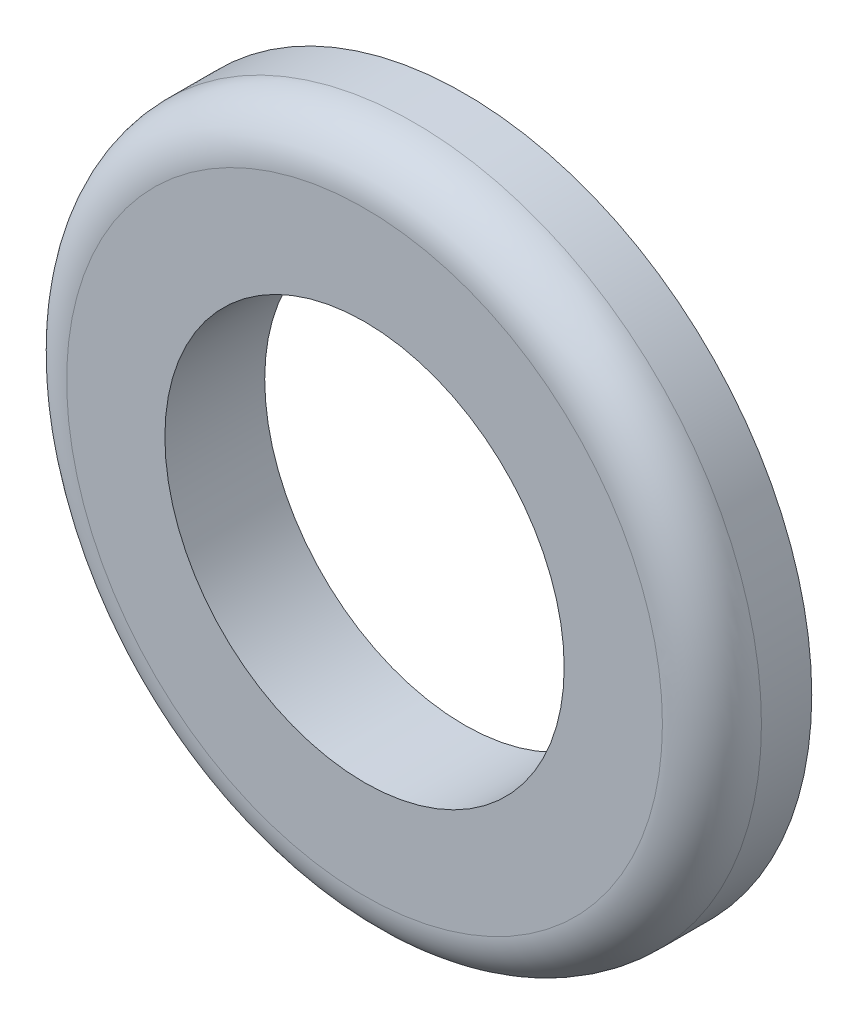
SolidWorks part; units mm, degrees
ref_plane "Front Plane" through (0, 0, 0) normal (0, 0, 1) x (1, 0, 0)
ref_plane "Top Plane" through (0, 0, 0) normal (0, 1, 0) x (1, 0, 0)
ref_plane "Right Plane" through (0, 0, 0) normal (1, 0, 0) x (0, 0, -1)
sketch "Sketch1" plane through (0, 0, 0) normal (0, 0, 1) x (1, 0, 0)
  circle A0 centre (0, 0) radius 5.5245
  circle A1 centre (0, 0) radius 3.175
  dimension "D1" = 6.35
  dimension "D2" = 11.049
extrude "Boss-Extrude1" add sketch "Sketch1" along normal blind 1.5875
fillet "Fillet1" radius 0.7874 1 edges at (5.5245, 0, 1.5875)
